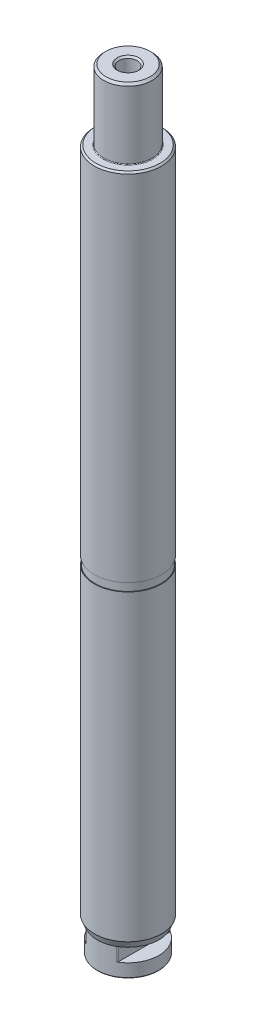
SolidWorks part; units mm, degrees
ref_plane "Спереди" through (0, 0, 0) normal (0, 0, 1) x (1, 0, 0)
ref_plane "Сверху" through (0, 0, 0) normal (0, 1, 0) x (1, 0, 0)
ref_plane "Справа" through (0, 0, 0) normal (1, 0, 0) x (0, 0, -1)
sketch "Эскиз1" plane through (0, 0, 0) normal (0, 0, 1) x (1, 0, 0)
  line L0 (0, 0) -> (0, 234.2787) construction
  line L1 (11.45, 0) -> (11.45, 10)
  line L2 (11.45, 10) -> (12.5, 12.5)
  line L3 (12.5, 12.5) -> (12.5, 125.1)
  line L4 (12.5, 125.1) -> (12.25, 125.1)
  line L5 (12.25, 125.1) -> (12.25, 128.1)
  line L6 (12.25, 128.1) -> (12.5, 128.1)
  line L7 (12.5, 128.1) -> (12.5, 260.2)
  line L8 (12.5, 260.2) -> (9, 260.2)
  line L9 (9, 260.2) -> (9, 286.2)
  line L10 (9, 286.2) -> (0, 286.2)
  line L11 (0, 286.2) -> (0, 0)
  line L12 (0, 0) -> (11.45, 0)
  dimension "D1" = 25
  dimension "D2" = 25
  dimension "D3" = 24.5
  dimension "D4" = 22.9
  dimension "D5" = 18
  dimension "D6" = 26
  dimension "D7" = 10
  dimension "D8" = 2.5
  dimension "D9" = 3
  dimension "D10" = 115.1
  dimension "D11" = 286.2
  dimension "D12" = 132.1
revolve "Повернуть1" add sketch "Эскиз1" angle 360 about L0
sketch "Эскиз3" plane through (0, 0, 0) normal (0, -1, 0) x (1, 0, 0)
  line L1 (5.95, -12.5) -> (-5.95, -12.5)
  line L2 (5.95, -12.5) -> (5.95, 12.5)
  line L3 (5.95, 12.5) -> (-5.95, 12.5)
  line L4 (-5.95, -12.5) -> (-5.95, 12.5)
  line L5 (0, 12.5) -> (0, -12.5) construction
  line L6 (5.95, 0) -> (-5.95, 0) construction
  circle A0 centre (0, 0) radius 12.5 construction
  point P0 (0, 0)
  dimension "D1" = 11.9
extrude "Вырез-Вытянуть1" cut sketch "Эскиз3" against normal blind 5 from offset 5 flip side to cut
fillet "Скругление1" radius 0.25 2 edges at (0, 260.2, -9) (0, 0, -11.45)
chamfer "Фаска1" distance 0.6 angle 45 1 edges at (0, 260.2, -12.5)
chamfer "Фаска2" distance 0.8 angle 45 1 edges at (0, 286.2, -9)
hole_wizard "Отверстие обработанное метчиком M81" positions "Эскиз4" profile "Эскиз6" tap size "M8" standard "DIN"
sketch "Эскиз4" plane through (0, 286.2, 0) normal (0, 1, 0) x (1, 0, 0)
  point P0 (0, 0)
sketch "Эскиз6" plane through (0, 286.2, 0) normal (1, 0, 0) x (0, 0, 1)
  line L0 (0, 0) -> (0, 31.0429)
  line L1 (0, 31.0429) -> (3.4, 29)
  line L2 (3.4, 29) -> (3.4, 0.625)
  line L3 (3.4, 0.625) -> (4.025, 0)
  line L5 (4.025, 0) -> (0, 0)
  line L6 (-3.4, 0.625) -> (-4.025, 0) construction
  line L10 (0, 31.0429) -> (-3.4, 29) construction
  line L11 (0, -6.35) -> (0, 107.95) construction
  dimension "Диаметр сверла" = 6.8
  dimension "Глубина сверла" = 29
  dimension "Диаметр передней зенковки" = 8.05
  dimension "Угол передней зенковки" = 90
  dimension "Угол заточки сверла" = 118
hole_wizard "Диаметр отверстия Ø2.2 (2.2)1" positions "Эскиз7" profile "Эскиз8" hole size "Ø2.2" standard "DIN"
sketch "Эскиз7" plane through (0, 0, 0) normal (0, -1, 0) x (-1, 0, 0)
  point P0 (0, 0)
sketch "Эскиз8" plane through (0, 0, 0) normal (1, 0, 0) x (0, 0, -1)
  line L0 (0, 0) -> (0, 4.4109)
  line L1 (0, 4.4109) -> (1.1, 3.75)
  line L2 (1.1, 3.75) -> (1.1, 0.65)
  line L3 (1.1, 0.65) -> (1.75, 0)
  line L5 (1.75, 0) -> (0, 0)
  line L6 (-1.1, 0.65) -> (-1.75, 0) construction
  line L10 (0, 4.4109) -> (-1.1, 3.75) construction
  line L11 (0, -6.35) -> (0, 107.95) construction
  dimension "Диаметр отверстия" = 2.2
  dimension "Глубина отверстия" = 3.75
  dimension "Диаметр передней зенковки" = 3.5
  dimension "Угол передней зенковки" = 90
  dimension "Угол заточки сверла" = 118
fillet "Скругление2" radius 0.6 4 edges at (5.95, 7.5, -9.7826) (5.95, 7.5, 9.7826) (-5.95, 7.5, -9.7826) (-5.95, 7.5, 9.7826)
